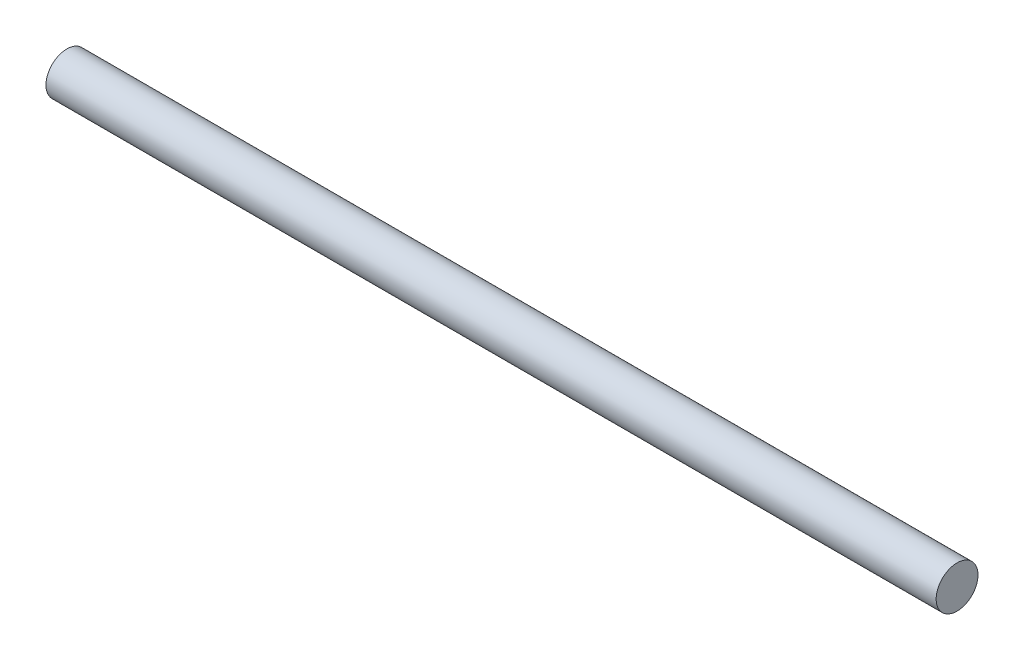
SolidWorks part; units mm, degrees
ref_plane "Front Plane" through (0, 0, 0) normal (0, 0, 1) x (1, 0, 0)
ref_plane "Top Plane" through (0, 0, 0) normal (0, 1, 0) x (1, 0, 0)
ref_plane "Right Plane" through (0, 0, 0) normal (1, 0, 0) x (0, 0, -1)
sketch "Sketch1" plane through (0, 0, 0) normal (0, 0, 1) x (1, 0, 0)
  line L0 (-79.6568, 0) -> (-12.6568, 0)
  dimension "D1" = 67
sketch3d "3DSketch1"
  line L0 (-79.6568, 0, 0) -> (-12.6568, 0, 0) construction
  circle A0 centre (-12.6568, 0, 0) radius 1.575
  point P2 (-11.0818, 0, 0)
  dimension "D1" = 3.15
sweep "Sweep1" add profiles "3DSketch1" path "Sketch1"
